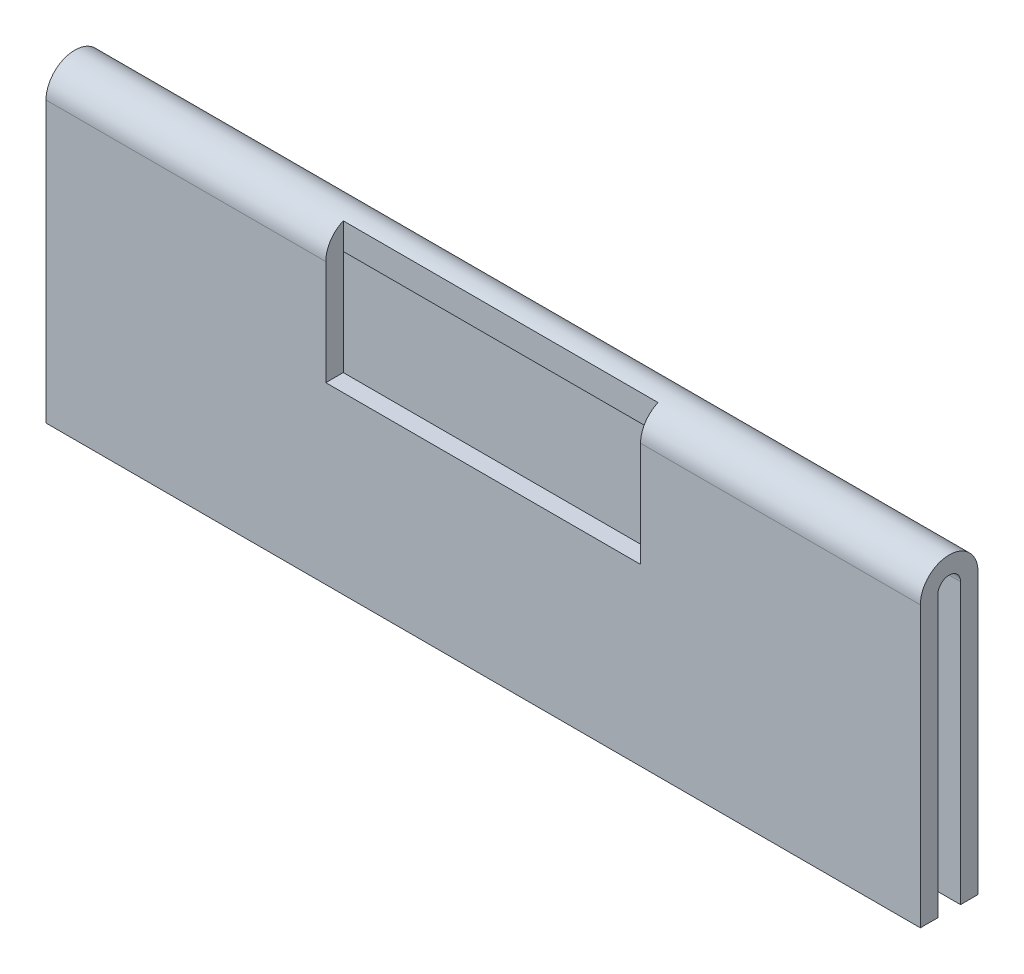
SolidWorks part; units mm, degrees
ref_plane "Front Plane" through (0, 0, 0) normal (0, 0, 1) x (1, 0, 0)
ref_plane "Top Plane" through (0, 0, 0) normal (0, 1, 0) x (1, 0, 0)
ref_plane "Right Plane" through (0, 0, 0) normal (1, 0, 0) x (0, 0, -1)
sketch "Schizzo1" plane through (0, 0, 0) normal (0, 0, 1) x (1, 0, 0)
  line L1 (-125, 40) -> (125, 40)
  line L2 (-125, 40) -> (-125, -40)
  line L3 (-125, -40) -> (125, -40)
  line L4 (125, 40) -> (125, -40)
  dimension "D1" = 250
  dimension "D2" = 125
  dimension "D3" = 80
  dimension "D4" = 40
extrude "Estrusione-Estrusione1" add sketch "Schizzo1" along normal blind 5
sketch "Schizzo2" plane through (0, 40, 0) normal (0, 1, 0) x (1, 0, 0)
  line L0 (-125, -8.2418) -> (127.314, -8.2418) construction
  line L1 (-125, 0) -> (125, 0)
  line L2 (-125, 0) -> (-125, -5)
  line L3 (-125, -5) -> (125, -5)
  line L4 (125, 0) -> (125, -5)
revolve "Rivoluzione1" add sketch "Schizzo2" angle 180 about L0
sketch "Schizzo3" plane through (0, 40, 0) normal (0, -1, 0) x (1, 0, 0)
  line L1 (-125, 16.4836) -> (125, 16.4836)
  line L2 (-125, 16.4836) -> (-125, 11.4836)
  line L3 (-125, 11.4836) -> (125, 11.4836)
  line L4 (125, 16.4836) -> (125, 11.4836)
extrude "Estrusione-Estrusione2" add sketch "Schizzo3" along normal blind 80
sketch "Schizzo4" plane through (0, -40, 0) normal (0, -1, 0) x (1, 0, 0)
  line L0 (125, 16.4836) -> (-125, 16.4836) construction
  line L1 (-45, 16.4836) -> (45, 16.4836)
  line L2 (-45, 16.4836) -> (-45, 11.4836)
  line L3 (-45, 11.4836) -> (45, 11.4836)
  line L4 (45, 16.4836) -> (45, 11.4836)
  line L5 (-125, 11.4836) -> (125, 11.4836) construction
  line L6 (125, 11.4836) -> (125, 16.4836) construction
  dimension "D1" = 90
  dimension "D2" = 80
extrude "Taglio-Estrusione1" cut sketch "Schizzo4" against normal blind 80 from offset 50
